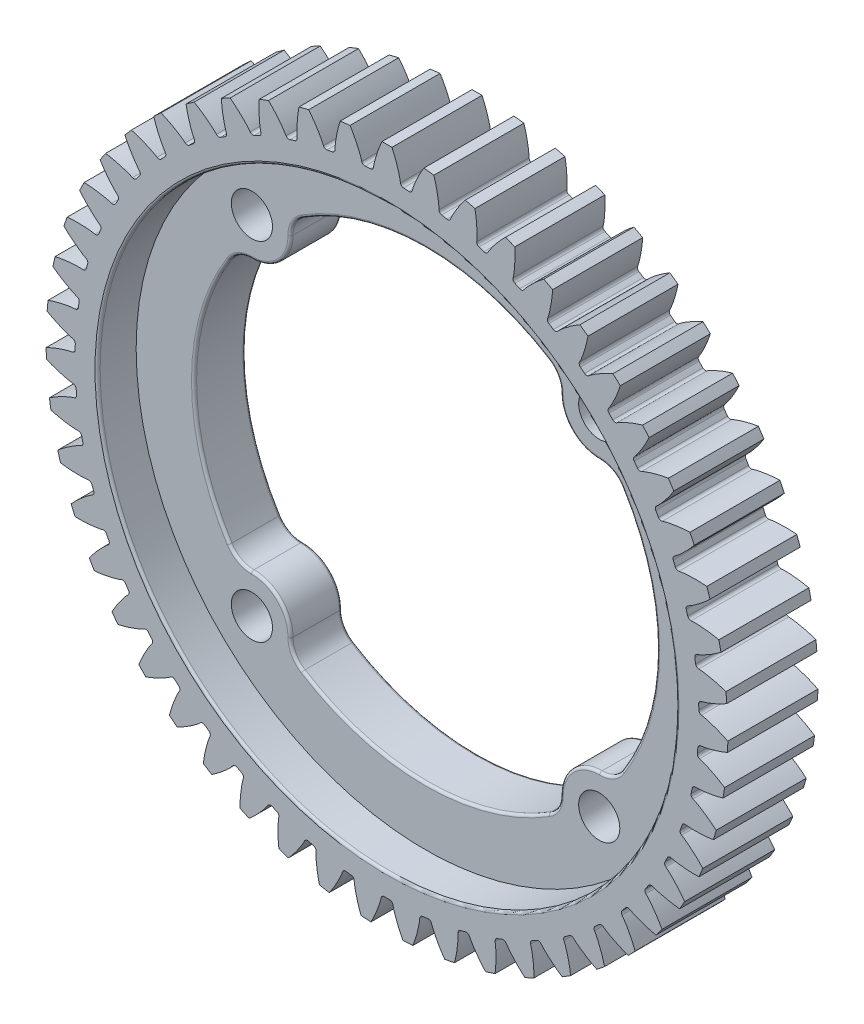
SolidWorks part; units mm, degrees
ref_plane "Plane1" through (0, 0, 0) normal (0, 0, 1) x (1, 0, 0)
ref_plane "Plane2" through (0, 0, 0) normal (0, 1, 0) x (1, 0, 0)
ref_plane "Plane3" through (0, 0, 0) normal (1, 0, 0) x (0, 0, -1)
sketch "Esquisse1" plane through (0, 0, 0) normal (0, 0, 1) x (1, 0, 0)
  line L0 (0, 0) -> (0, 42) construction
  arc A0 (0.7853, 25.4879) -> (-0.7853, 25.4879) centre (0, 0) ccw
  dimension "D2" = 25.5
  dimension "D1" = 3.529
sketch "Esquisse2" plane through (0, 0, 0) normal (0, 0, 1) x (1, 0, 0)
  line L0 (0, 0) -> (0, 37) construction
  arc A0 (0.9372, 24.9698) -> (-0.9372, 24.9698) centre (0, 0) ccw
  dimension "D2" = 24.9874
  dimension "D1" = 4.299
sketch "Esquisse3" plane through (0, 0, 0) normal (0, 0, 1) x (1, 0, 0)
  line L0 (0, 0) -> (0, 33) construction
  arc A0 (1.0468, 24.4524) -> (-1.0468, 24.4524) centre (0, 0) ccw
  dimension "D2" = 24.4748
  dimension "D1" = 4.902
sketch "Esquisse4" plane through (0, 0, 0) normal (0, 0, 1) x (1, 0, 0)
  line L0 (0, 0) -> (0, 30) construction
  arc A0 (1.0948, 23.9371) -> (-1.0948, 23.9371) centre (0, 0) ccw
  dimension "D2" = 23.9622
  dimension "D1" = 5.237
sketch "Esquisse5" plane through (0, 0, 0) normal (0, 0, 1) x (1, 0, 0)
  line L0 (0, 0) -> (0, 46) construction
  arc A0 (0.6669, 25.8247) -> (-0.6669, 25.8247) centre (0, 0) ccw
  dimension "D2" = 25.8333
  dimension "D1" = 2.958
sketch "Esquisse6" plane through (0, 0, 0) normal (0, 0, 1) x (1, 0, 0)
  line L0 (0, 0) -> (0, 50) construction
  arc A0 (0.5343, 26.1612) -> (-0.5343, 26.1612) centre (0, 0) ccw
  dimension "D2" = 26.1667
  dimension "D1" = 2.34
sketch "Esquisse7" plane through (0, 0, 0) normal (0, 0, 1) x (1, 0, 0)
  line L0 (0, 0) -> (0, 54) construction
  arc A0 (0.3883, 26.4972) -> (-0.3883, 26.4972) centre (0, 0) ccw
  dimension "D2" = 26.5
  dimension "D1" = 1.679
ref_plane "Plan1" through (0, 0, 7) normal (0, 0, 1) x (1, 0, 0)
sketch "Esquisse8" plane through (0, 0, 7) normal (0, 0, 1) x (1, 0, 0)
  line L0 (0, 0) -> (0, 18) construction
  arc A0 (0.7853, 25.4879) -> (-0.7853, 25.4879) centre (0, 0) ccw
  dimension "D2" = 25.5
  dimension "D1" = 3.529
sketch "Esquisse9" plane through (0, 0, 7) normal (0, 0, 1) x (1, 0, 0)
  line L0 (0, 0) -> (0, 15) construction
  arc A0 (0.9372, 24.9698) -> (-0.9372, 24.9698) centre (0, 0) ccw
  dimension "D2" = 24.9874
  dimension "D1" = 4.299
sketch "Esquisse10" plane through (0, 0, 7) normal (0, 0, 1) x (1, 0, 0)
  line L0 (0, 0) -> (0, 13) construction
  arc A0 (1.0468, 24.4524) -> (-1.0468, 24.4524) centre (0, 0) ccw
  dimension "D2" = 24.4748
  dimension "D1" = 4.902
sketch "Esquisse11" plane through (0, 0, 7) normal (0, 0, 1) x (1, 0, 0)
  line L0 (0, 0) -> (0, 12) construction
  arc A0 (1.0948, 23.9371) -> (-1.0948, 23.9371) centre (0, 0) ccw
  dimension "D2" = 23.9622
  dimension "D1" = 5.237
sketch "Esquisse12" plane through (0, 0, 7) normal (0, 0, 1) x (1, 0, 0)
  line L0 (0, 0) -> (0, 20) construction
  arc A0 (0.6669, 25.8247) -> (-0.6669, 25.8247) centre (0, 0) ccw
  dimension "D2" = 25.8333
  dimension "D1" = 2.958
sketch "Esquisse13" plane through (0, 0, 7) normal (0, 0, 1) x (1, 0, 0)
  line L0 (0, 0) -> (0, 21) construction
  arc A0 (0.5343, 26.1612) -> (-0.5343, 26.1612) centre (0, 0) ccw
  dimension "D2" = 26.1667
  dimension "D1" = 2.34
sketch "Esquisse14" plane through (0, 0, 7) normal (0, 0, 1) x (1, 0, 0)
  line L0 (0, 0) -> (0, 22) construction
  arc A0 (0.3883, 26.4972) -> (-0.3883, 26.4972) centre (0, 0) ccw
  dimension "D2" = 26.5
  dimension "D1" = 1.679
sketch "Esquisse15" plane through (0, 0, 0) normal (0, 0, 1) x (1, 0, 0)
  circle A0 centre (0, 0) radius 24.25
  dimension "D1" = 48.5
sketch "Esquisse16" plane through (0, 0, 7) normal (0, 0, 1) x (1, 0, 0)
  circle A0 centre (0, 0) radius 24.25
  dimension "D1" = 48.5
surface "Surface-Lissage1"
surface "Surface-Lissage2"
surface "Surface-Lissage3"
surface "Surface-Lissage4"
surface "Surface-Lissage5"
surface "Surface-Lissage6"
surface "Surface-Lissage7"
loft "Base-Lissage" add
loft "Boss.-Lissage1" add profiles "Esquisse15", "Esquisse16"
fillet "Congé1" radius 0.25
pattern_circular "Répétition circulaire1" count 51 over 360
sketch "Esquisse17" plane through (0, 0, 0) normal (0, 0, -1) x (-1, 0, 0)
  circle A0 centre (0, 0) radius 18
  dimension "D1" = 36
extrude "Enlèv. mat.-Extru.1" cut sketch "Esquisse17" against normal blind 10
sketch "Esquisse18" plane through (0, 0, 7) normal (0, 0, 1) x (1, 0, 0)
  circle A0 centre (0, 0) radius 22.5
  dimension "D1" = 45
extrude "Enlèv. mat.-Extru.2" cut sketch "Esquisse18" against normal blind 3
sketch "Esquisse19" plane through (0, 0, 0) normal (0, 0, -1) x (-1, 0, 0)
  circle A0 centre (-13.5, 13.5) radius 3
  dimension "D2" = 6
  dimension "D1" = 13.5
  dimension "D3" = 13.5
extrude "Extrusion1" add sketch "Esquisse19" against normal up to surface (4 mm away)
sketch "Esquisse20" plane through (0, 0, 0) normal (0, 0, -1) x (-1, 0, 0)
  circle A0 centre (-13.5, 13.5) radius 1.6
  dimension "D1" = 3.2
extrude "Enlèv. mat.-Extru.3" cut sketch "Esquisse20" against normal through all
pattern_circular "Répétition circulaire2" count 4 over 360
fillet "Congé2" radius 2
fillet "Congé4" radius 0.2
ref_plane "Plan2" through (0, 0, 3.5) normal (0, 0, 1) x (1, 0, 0)
sketch "Esquisse21" plane through (0, 0, 3.5) normal (0, 0, 1) x (1, 0, 0)
  circle A0 centre (0, 0) radius 25.5
  dimension "D1" = 51
extrude "Extru.-Mince1" [suppressed] add sketch "Esquisse21" along normal mid plane 2 thin
